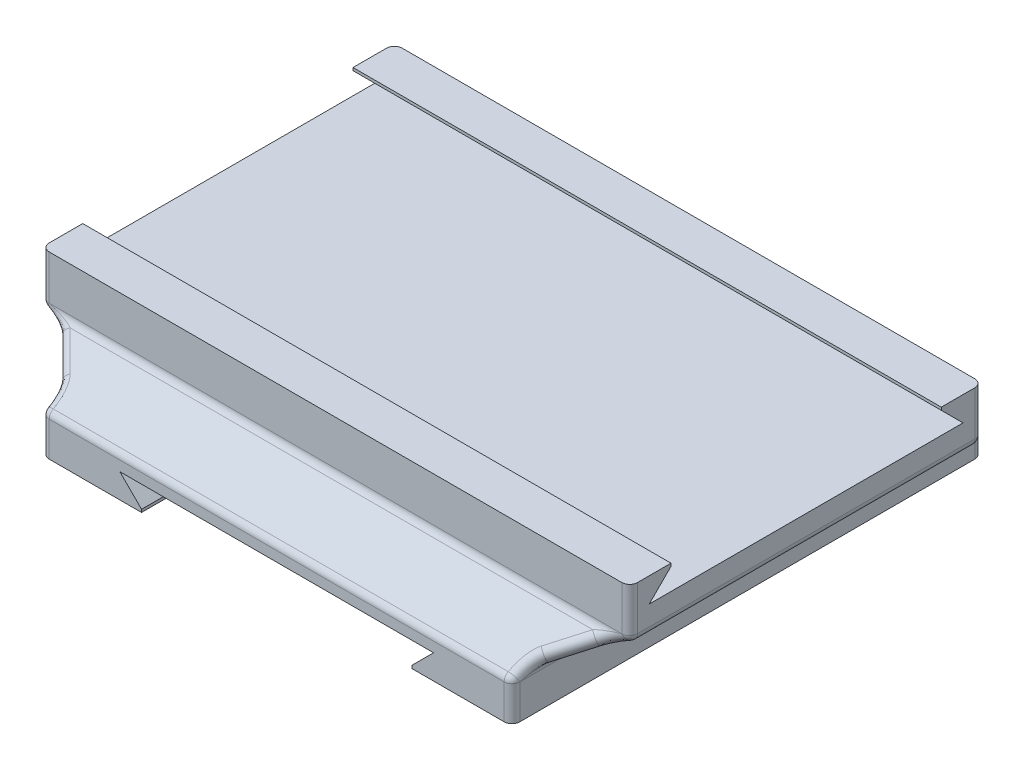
SolidWorks part; units mm, degrees
ref_plane "Front Plane" through (0, 0, 0) normal (0, 0, 1) x (1, 0, 0)
ref_plane "Top Plane" through (0, 0, 0) normal (0, 1, 0) x (1, 0, 0)
ref_plane "Right Plane" through (0, 0, 0) normal (1, 0, 0) x (0, 0, -1)
other "Configuration Table"
sketch "Sketch1" plane through (0, 0, 0) normal (0, 1, 0) x (1, 0, 0)
  line L0 (-152.4, -152.4) -> (152.4, 152.4) construction
  line L1 (-152.4, 152.4) -> (152.4, 152.4)
  line L2 (-152.4, 152.4) -> (-152.4, -152.4)
  line L3 (-152.4, -152.4) -> (152.4, -152.4)
  line L4 (152.4, 152.4) -> (152.4, -152.4)
  dimension "D1" = 304.8
  dimension "D2" = 304.8
extrude "Extrude1" add sketch "Sketch1" along normal blind 25.4
ref_plane "Plane1" through (0, 46.3899, 0) normal (0, 1, 0) x (-1, 0, 0)
sketch "Sketch2" plane through (0, 46.3899, 0) normal (0, 1, 0) x (-1, 0, 0)
  line L0 (190.5, -114.3) -> (-190.5, 114.3) construction
  line L1 (190.5, -114.3) -> (-190.5, -114.3)
  line L2 (190.5, -114.3) -> (190.5, 114.3)
  line L3 (190.5, 114.3) -> (-190.5, 114.3)
  line L4 (-190.5, -114.3) -> (-190.5, 114.3)
  dimension "D1" = 381
  dimension "D2" = 228.6
extrude "Extrude2" add sketch "Sketch2" along normal blind 31.75
loft "Loft1" add
sketch "Sketch3" plane through (0, 0, 0) normal (1, 0, 0) x (0, 0, -1)
  line L0 (-85.725, 78.1399) -> (-101.6, 62.2649)
  line L1 (-114.3, 78.1399) -> (114.3, 78.1399) construction
  line L2 (-101.6, 62.2649) -> (101.6, 62.2649)
  line L3 (101.6, 62.2649) -> (85.725, 78.1399)
  line L4 (0, 62.2649) -> (0, 0) construction
  dimension "D1" = 203.2
  dimension "D2" = 45
  dimension "D3" = 15.875
extrude "Cut-Extrude1" cut sketch "Sketch3" against normal through all and the other way through all
sketch "Sketch4" plane through (0, 0, 0) normal (0, 0, 1) x (1, 0, 0)
  line L0 (-85.725, 0) -> (-101.6, 15.875)
  line L1 (-152.4, 0) -> (152.4, 0) construction
  line L2 (-101.6, 15.875) -> (101.6, 15.875)
  line L3 (101.6, 15.875) -> (85.725, 0)
  line L4 (0, 0) -> (0, 15.875) construction
  dimension "D1" = 45
  dimension "D2" = 15.875
  dimension "D3" = 203.2
extrude "Cut-Extrude2" cut sketch "Sketch4" against normal through all and the other way through all flip side to cut
chamfer "Chamfer1" distance 2.54 angle 45 4 edges at (85.725, 0, 0) (0, 78.1399, 85.725) (0, 78.1399, -85.725) (-85.725, 0, 0)
fillet "Fillet1" radius 5.08 4 edges at (-152.4, 25.4, 0) (152.4, 25.4, 0)
fillet "Fillet3" radius 5.08 8 edges at (0, 25.4, 152.4) (0, 25.4, -152.4) (-154.1259, 26.2141, 150.9223) (154.1259, 26.2141, 150.9223) (154.1259, 26.2141, -150.9223) (-154.1259, 26.2141, -150.9223)
fillet "Fillet2" radius 5.08 20 edges at (-152.4, 11.1994, -152.4) (152.4, 11.1994, -152.4) (-152.4, 11.1994, 152.4) (152.4, 11.1994, 152.4) (-189.7937, 46.8072, -115.0063) (-153.1063, 24.9827, -151.6937) (189.7937, 46.8072, -115.0063) (153.1063, 24.9827, -151.6937) (-189.7937, 46.8072, 115.0063) (-153.1063, 24.9827, 151.6937) (189.7937, 46.8072, 115.0063) (153.1063, 24.9827, 151.6937)
